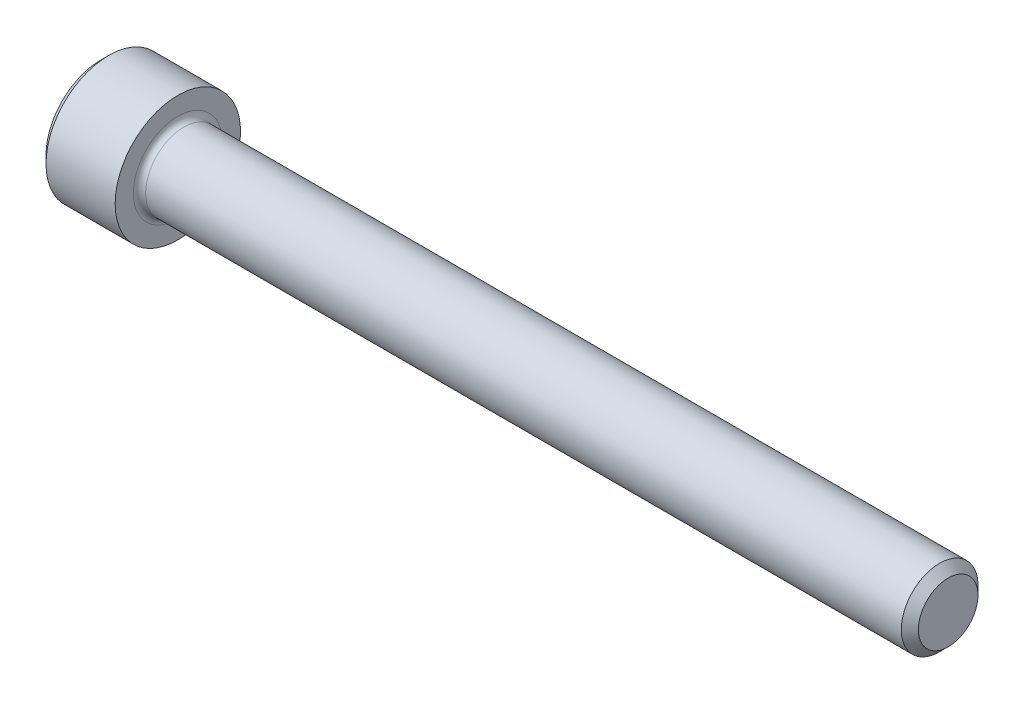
SolidWorks part; units mm, degrees
ref_plane "Plane1" through (0, 0, 0) normal (0, 0, 1) x (1, 0, 0)
ref_plane "Plane2" through (0, 0, 0) normal (0, 1, 0) x (1, 0, 0)
ref_plane "Plane3" through (0, 0, 0) normal (1, 0, 0) x (0, 0, -1)
sketch "BodySke" plane through (0, 0, 0) normal (0, 0, 1) x (1, 0, 0)
  line L0 (0, 0) -> (0, 2.0447)
  line L1 (0.2794, 2.3241) -> (2.8448, 2.3241)
  line L2 (2.8448, 2.3241) -> (2.8448, 1.4224)
  line L3 (2.8448, 1.4224) -> (31.1036, 1.4224)
  line L4 (31.4198, 1.1062) -> (31.4198, 0)
  line L5 (31.4198, 0) -> (0, 0)
  line L6 (-31.75, 0) -> (127, 0) construction
  line L7 (0, 2.0447) -> (0.2794, 2.3241)
  line L8 (31.4198, 1.1062) -> (31.1036, 1.4224)
  line L9 (0, -2.0447) -> (0.2794, -2.3241) construction
  line L10 (31.4198, -1.1062) -> (31.1036, -1.4224) construction
  line L11 (3.3731, 9.525) -> (3.3731, 3.175) construction
  line L12 (2.8448, 9.525) -> (2.8448, 3.175) construction
  line L13 (-6.6802, 9.525) -> (-6.6802, 3.175) construction
  dimension "Diameter" = 2.8448
  dimension "Head_ht" = 2.8448
  dimension "Length" = 28.575
  dimension "Body_ch_ang" = 45
  dimension "Head_dia" = 4.6482
  dimension "Head_ch_ang" = 45
  dimension "Head_side_ht" = 2.5654
  dimension "Minor_dia" = 2.2123
  dimension "Advance" = 0.5283
  dimension "Thread_nom" = 28.575
  dimension "Thread_length" = 38.1
revolve "Base-Revolve" add sketch "BodySke"
fillet "Fillet1" radius 0.2286 1 edges at (2.8448, 0, 1.4224)
sketch "Sketch2" plane through (0, 0, 0) normal (0, 0, 1) x (1, 0, 0)
  line L0 (0, 1.1938) -> (1.2954, 1.1938)
  line L1 (1.2954, 1.1938) -> (1.9846, 0)
  line L2 (-31.75, 0) -> (127, 0) construction
  line L3 (1.9846, 0) -> (0, 0)
  line L4 (0, 0) -> (0, 1.1938)
  line L5 (0, 2.0447) -> (0, -2.0447) construction
  line L6 (0, 0) -> (47.625, 0) construction
  line L7 (2.8448, -2.3241) -> (2.8448, 2.3241) construction
  dimension "D1" = 1.1938
  dimension "D2" = 60
  dimension "Wall_thickness" = 1.5494
revolve "Hex-PreBroach" cut sketch "Sketch2" angle 360 about L6
sketch "Sketch3" plane through (0, 0, 0) normal (-1, 0, 0) x (0, 0.5, 0.866)
  line L0 (0.6892, 1.1938) -> (-0.6892, 1.1938)
  line L1 (-0.6892, 1.1938) -> (-1.3785, 0)
  line L2 (0.6892, 1.1938) -> (1.3785, 0)
  line L3 (0.6892, -1.1938) -> (1.3785, 0)
  line L4 (0.6892, -1.1938) -> (-0.6892, -1.1938)
  line L5 (-0.6892, -1.1938) -> (-1.3785, 0)
  dimension "D1" = 1.1938
  dimension "D2" = 1.1938
  dimension "Hex_size" = 2.3876
extrude "Hex" cut sketch "Sketch3" against normal blind 1.2954
sketch "Sketch4" plane through (0, 0, 0) normal (-1, 0, 0) x (0, 0, 1)
  line L0 (0, 0) -> (1.4605, 0)
  line L1 (0, 0) -> (6.1484, 3.5498) construction
  line L2 (0, 0) -> (0.7302, 1.2648)
  line L3 (1.2009, 0.3267) -> (1.3933, 0.4378)
  line L4 (0.8834, 0.8767) -> (1.0758, 0.9877)
  arc A0 (1.2009, 0.3267) -> (0.8834, 0.8767) centre (0, 0) ccw
  arc A1 (1.4605, 0) -> (1.3933, 0.4378) centre (0, 0) ccw
  arc A2 (0.7302, 1.2648) -> (1.0758, 0.9877) centre (0, 0) cw
  dimension "D1" = 30
  dimension "Spline_n_dim" = 2.4892
  dimension "Spline_m_dim" = 2.921
  dimension "D2" = 60
  dimension "D3" = 0.3175
  dimension "Spline_p_dim" = 0.635
extrude "Spline" [suppressed] cut sketch "Sketch4" against normal blind 1.2954
pattern_circular "CirPattern1" [suppressed] count 6 every 60
sketch "Sketch5" plane through (0, 0, 0) normal (0, 0, 1) x (1, 0, 0)
  line L0 (-31.75, 0) -> (127, 0) construction
  line L2 (0, 2.0447) -> (0, -2.0447) construction
  circle A0 centre (1.016, 0) radius 0.4445
  dimension "Drilled_hole_dia" = 0.889
  dimension "Drilled_hole_loc" = 1.016
extrude "Hole" [suppressed] cut sketch "Sketch5" against normal through all and the other way through all
pattern_circular "Drilled-4" [suppressed] count 2 every 60
pattern_circular "Drilled-6" [suppressed] count 3 every 60
sketch "ThdSchSke" plane through (0, 0, 0) normal (0, 0, 1) x (1, 0, 0)
  line L0 (3.3731, -1.1062) -> (3.1517, -1.4224)
  line L1 (3.3731, -1.1062) -> (3.5945, -1.4224)
  line L2 (3.5945, -1.4224) -> (3.5945, -1.778)
  line L3 (-3.175, 0) -> (5.1513, 0) construction
  line L5 (3.5945, -1.778) -> (3.1517, -1.778)
  line L6 (3.1517, -1.778) -> (3.1517, -1.4224)
  line L7 (0, 2.0447) -> (0, -2.0447) construction
  dimension "Thread_minor" = 2.2123
  dimension "Diameter" = 2.8448
  dimension "Start" = 3.3731
  dimension "SideAngle" = 55
  dimension "VeeAngle" = 70
  dimension "Overcut" = 3.556
revolve "ThreadSchematic" [suppressed] cut sketch "ThdSchSke" angle 360 about L3
pattern_linear "ThdSchPat" [suppressed]
equation "\"D2@Sketch3\" = \"Hex_size@Sketch3\" / 2"
equation "\"D1@Sketch3\" = \"Hex_size@Sketch3\" / 2"
equation "\"D1@Sketch2\" = \"Hex_size@Sketch3\" / 2"
equation "\"D3@Sketch4\" = \"Spline_p_dim@Sketch4\" / 2"
equation "\"Thread_minor@ThreadCosmetic\"  =  \"Minor_dia@BodySke\""
equation "\"D2@CirPattern1\" = 360 / \"Num_teeth@CirPattern1\""
equation "\"Wall_thickness@Sketch2\" = \"Head_ht@BodySke\" - \"Key_eng@Hex\""
equation "\"Thread_length@ThreadCosmetic\" = ((sgn( (\"Length@BodySke\" - \"Advance@BodySke\" ) - \"Thread_nom@BodySke\" )-1)*( (\"Length@BodySke\" - \"Advance@BodySke\" ) - \"Thread_nom@BodySke\" ))/-2+ \"Thread_nom@BodySke\""
equation "\"Thread_minor@ThdSchSke\" = \"Minor_dia@BodySke\""
equation "\"Diameter@ThdSchSke\" = \"Diameter@BodySke\""
equation "\"Overcut@ThdSchSke\" = \"Diameter@BodySke\" * 1.25"
equation "\"Start@ThdSchSke\" = \"Head_ht@BodySke\" + \"Length@BodySke\" - \"Thread_length@ThreadCosmetic\"  '---Non-countersunk---"
equation "\"Num_threads@ThdSchPat\" = int( \"Thread_length@ThreadCosmetic\" / \"Advance@BodySke\" + 0.999 )  + 1"
equation "\"Advance@ThdSchPat\" = \"Thread_length@ThreadCosmetic\" /  (\"Num_threads@ThdSchPat\" - 1) 'relax it"
equation "\"Num_threads@ThdSchPat\" = \"Num_threads@ThdSchPat\" - sgn( \"Num_threads@ThdSchPat\" - 1) '---chamfered tips only---"
